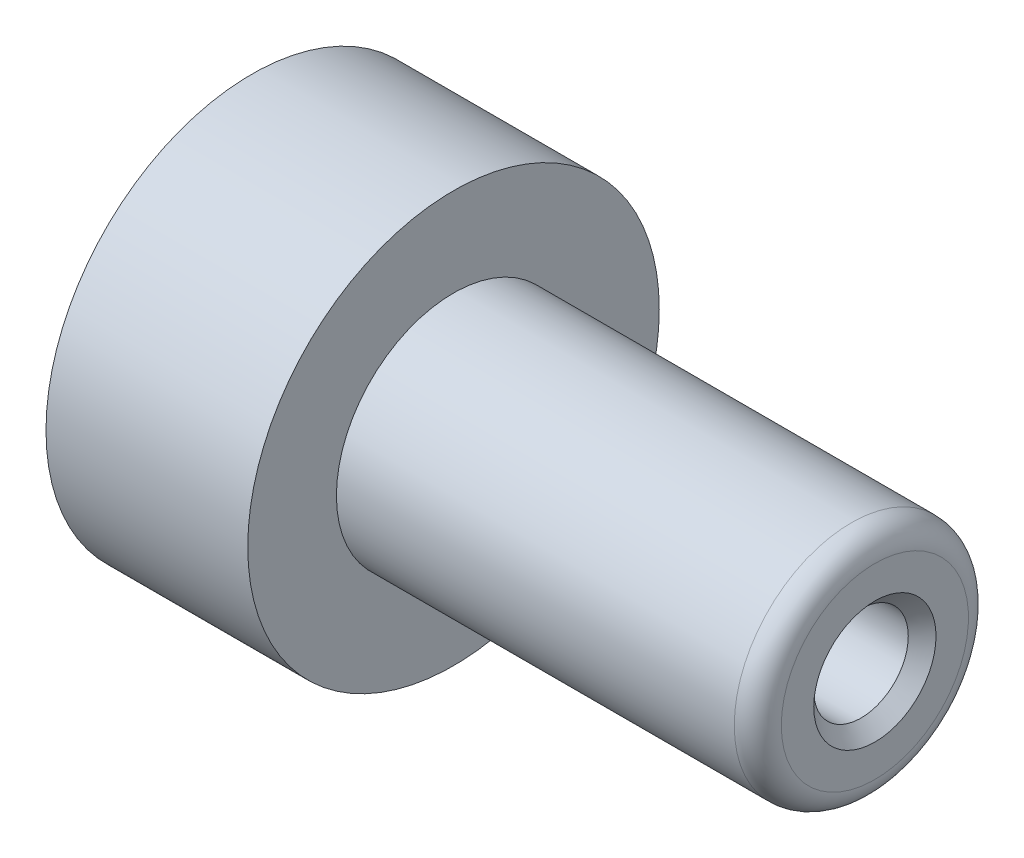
SolidWorks part; units mm, degrees
ref_plane "Front Plane" through (0, 0, 0) normal (0, 0, 1) x (1, 0, 0)
ref_plane "Top Plane" through (0, 0, 0) normal (0, 1, 0) x (1, 0, 0)
ref_plane "Right Plane" through (0, 0, 0) normal (1, 0, 0) x (0, 0, -1)
sketch "Sketch1" plane through (0, 0, 0) normal (0, 0, 1) x (1, 0, 0)
  line L0 (0, 0) -> (102.3864, 0) construction
  line L1 (0, 3.9751) -> (0, 11.1125)
  line L2 (0, 11.1125) -> (10.8966, 11.1125)
  line L3 (10.8966, 11.1125) -> (10.8966, 6.3246)
  line L4 (10.8966, 6.3246) -> (32.385, 6.3246)
  line L5 (33.655, 5.0546) -> (33.655, 0)
  line L6 (33.655, 0) -> (21.8948, 0)
  line L7 (0, 3.9751) -> (21.8948, 3.9751)
  line L8 (21.8948, 3.9751) -> (21.8948, 0)
  arc A0 (33.655, 5.0546) -> (32.385, 6.3246) centre (32.385, 5.0546) ccw
  dimension "D5" = 1.27
  dimension "D1" = 10.8966
  dimension "D2" = 22.225
  dimension "D3" = 21.8948
  dimension "D4" = 7.9502
  dimension "D6" = 33.655
  dimension "D7" = 12.6492
revolve "Revolve1" add sketch "Sketch1" angle 360 about L0
sketch "Sketch2" plane through (0, 0, 0) normal (-1, 0, 0) x (0, 0, 1)
  line L0 (0, 0) -> (0, 9.7644) construction
  circle A0 centre (-6.7437, 0) radius 1.2065
  circle A1 centre (6.7437, 0) radius 1.2065
  dimension "D2" = 2.413
  dimension "D1" = 13.4874
extrude "Cut-Extrude1" cut sketch "Sketch2" against normal blind 2.54
sketch "Sketch3" plane through (33.655, 0, 0) normal (1, 0, 0) x (0, 0, -1)
  circle A0 centre (0, 0) radius 2.5527
  dimension "D1" = 5.1054
extrude "Cut-Extrude2" cut sketch "Sketch3" against normal through all
chamfer "Chamfer1" distance 0.7493 angle 45 1 edges at (33.655, 0, -2.5527)
